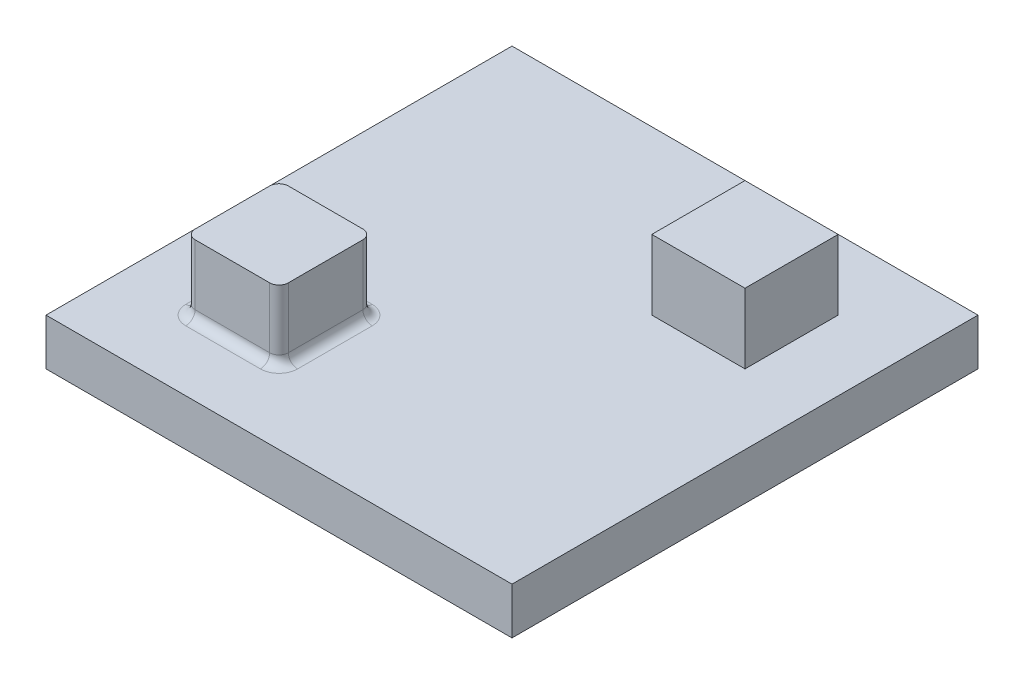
SolidWorks part; units mm, degrees
ref_plane "Front Plane" through (0, 0, 0) normal (0, 0, 1) x (1, 0, 0)
ref_plane "Top Plane" through (0, 0, 0) normal (0, 1, 0) x (1, 0, 0)
ref_plane "Right Plane" through (0, 0, 0) normal (1, 0, 0) x (0, 0, -1)
sketch "Sketch1" plane through (0, 0, 0) normal (0, 1, 0) x (1, 0, 0)
  line L0 (-63.5, -63.5) -> (63.5, 63.5) construction
  line L1 (-63.5, 63.5) -> (63.5, 63.5)
  line L2 (-63.5, 63.5) -> (-63.5, -63.5)
  line L3 (-63.5, -63.5) -> (63.5, -63.5)
  line L4 (63.5, 63.5) -> (63.5, -63.5)
  dimension "D1" = 127
  dimension "D2" = 127
extrude "Extrude1" add sketch "Sketch1" along normal blind 12.7
sketch "Sketch2" plane through (0, 12.7, 0) normal (0, 1, 0) x (-1, 0, 0)
  line L0 (63.5, 63.5) -> (-63.5, 63.5) construction
  line L1 (19.05, 19.05) -> (44.45, 19.05)
  line L2 (19.05, 19.05) -> (19.05, 44.45)
  line L3 (19.05, 44.45) -> (44.45, 44.45)
  line L4 (44.45, 19.05) -> (44.45, 44.45)
  line L5 (63.5, -63.5) -> (63.5, 63.5) construction
  dimension "D1" = 25.4
  dimension "D2" = 25.4
  dimension "D3" = 19.05
  dimension "D4" = 19.05
extrude "Extrude2" add sketch "Sketch2" along normal blind 19.05
fillet "Fillet1" radius 2.54 8 edges at (-19.05, 12.7, 31.75) (-19.05, 22.225, 44.45) (-31.75, 12.7, 19.05) (-19.05, 22.225, 19.05) (-44.45, 12.7, 31.75) (-44.45, 22.225, 19.05) (-31.75, 12.7, 44.45) (-44.45, 22.225, 44.45)
sketch "Sketch3" plane through (0, 12.7, 0) normal (0, 1, 0) x (-1, 0, 0)
  line L0 (-63.5, -63.5) -> (63.5, -63.5) construction
  line L1 (-19.05, -44.45) -> (-44.45, -44.45)
  line L2 (-19.05, -44.45) -> (-19.05, -19.05)
  line L3 (-19.05, -19.05) -> (-44.45, -19.05)
  line L4 (-44.45, -44.45) -> (-44.45, -19.05)
  line L5 (-63.5, 63.5) -> (-63.5, -63.5) construction
  dimension "D1" = 25.4
  dimension "D2" = 25.4
  dimension "D3" = 19.05
  dimension "D4" = 19.05
extrude "Extrude3" add sketch "Sketch3" along normal up to surface (19.05 mm away)
